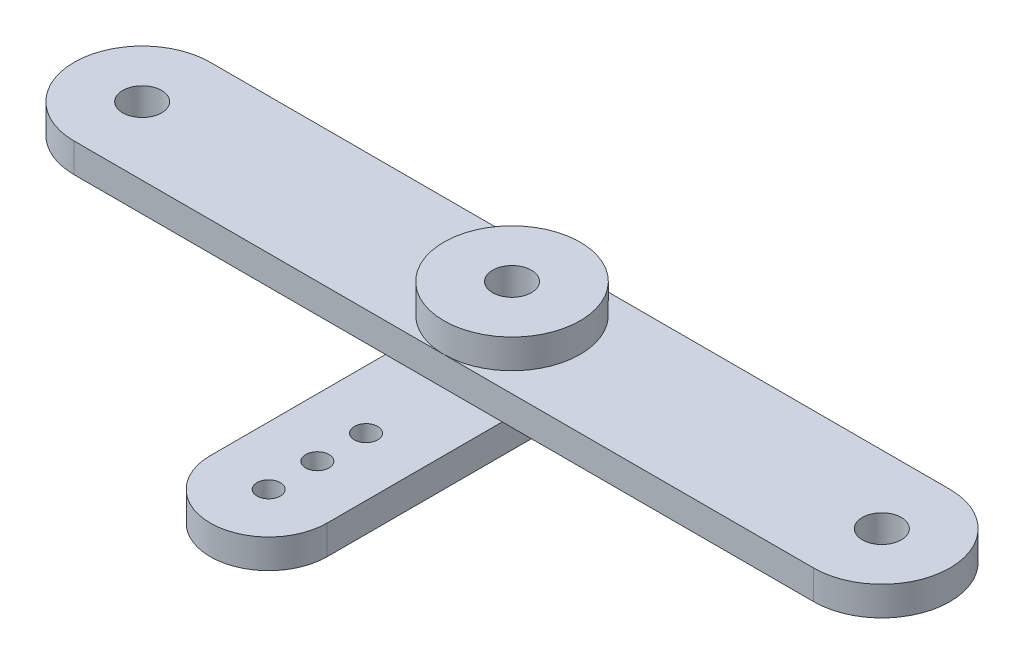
SolidWorks part; units mm, degrees
ref_plane "Plan de face" through (0, 0, 0) normal (0, 0, 1) x (1, 0, 0)
ref_plane "Plan de dessus" through (0, 0, 0) normal (0, 1, 0) x (1, 0, 0)
ref_plane "Plan de droite" through (0, 0, 0) normal (1, 0, 0) x (0, 0, -1)
sketch "Esquisse1" plane through (0, 0, 0) normal (0, 1, 0) x (1, 0, 0)
  line L0 (-43.9887, 0) -> (39.7879, 0) construction
  line L1 (0, -14.4319) -> (0, 38.8282) construction
  line L2 (22.5, -25.4157) -> (22.5, 14.3152) construction
  line L3 (-22.5, -25.4157) -> (-22.5, 14.3152) construction
  line L4 (39.7879, -3.5) -> (-43.9887, -3.5) construction
  line L5 (19, 10.048) -> (19, -5.553) construction
  line L6 (-19, -3.5) -> (19, -3.5)
  line L7 (-19, 3.5) -> (19, 3.5)
  arc A0 (19, -3.5) -> (19, 3.5) centre (19, 0) ccw
  circle A1 centre (19, 0) radius 1
  circle A2 centre (-19, 0) radius 1
  arc A3 (-19, -3.5) -> (-19, 3.5) centre (-19, 0) cw
  circle A4 centre (0, 0) radius 1
  dimension "D1" = 3.5
  dimension "D2" = 22.5
  dimension "D3" = 45
  dimension "D4" = 3.5
extrude "Boss.-Extru.1" add sketch "Esquisse1" along normal blind 1.5
sketch "Esquisse2" plane through (0, 1.5, 0) normal (0, 1, 0) x (1, 0, 0)
  line L0 (0, 11.7205) -> (0, -5.4229) construction
  circle A0 centre (0, 0) radius 3.5
  circle A1 centre (0, 0) radius 1
extrude "Boss.-Extru.2" add sketch "Esquisse2" along normal blind 1.5
sketch "Esquisse3" plane through (0, 0, 0) normal (0, -1, 0) x (1, 0, 0)
  line L0 (0, -7.0848) -> (0, 18.7179) construction
  line L1 (26.1444, -3.5) -> (-25.1716, -3.5) construction
  line L2 (26.1444, 15.5) -> (-5.7156, 15.5) construction
  line L3 (3, 25.1457) -> (3, -7.0848) construction
  line L4 (-3, 25.1457) -> (-3, -7.0848) construction
  line L5 (11.7899, 12.5) -> (-9.5668, 12.5) construction
  line L6 (3, 12.5) -> (3, -3.5)
  line L7 (3, -3.5) -> (-3, -3.5)
  line L8 (-3, -3.5) -> (-3, 12.5)
  arc A0 (3, 12.5) -> (-3, 12.5) centre (0, 12.5) ccw
  circle A1 centre (0, 12.5) radius 0.6
  circle A2 centre (0, 0) radius 1
  circle A3 centre (0, 10) radius 0.6
  circle A4 centre (0, 7.5) radius 0.6
  dimension "D5" = 3
  dimension "D1" = 19
  dimension "D2" = 3
  dimension "D3" = 3
  dimension "D4" = 6
extrude "Boss.-Extru.3" add sketch "Esquisse3" along normal blind 1.5
